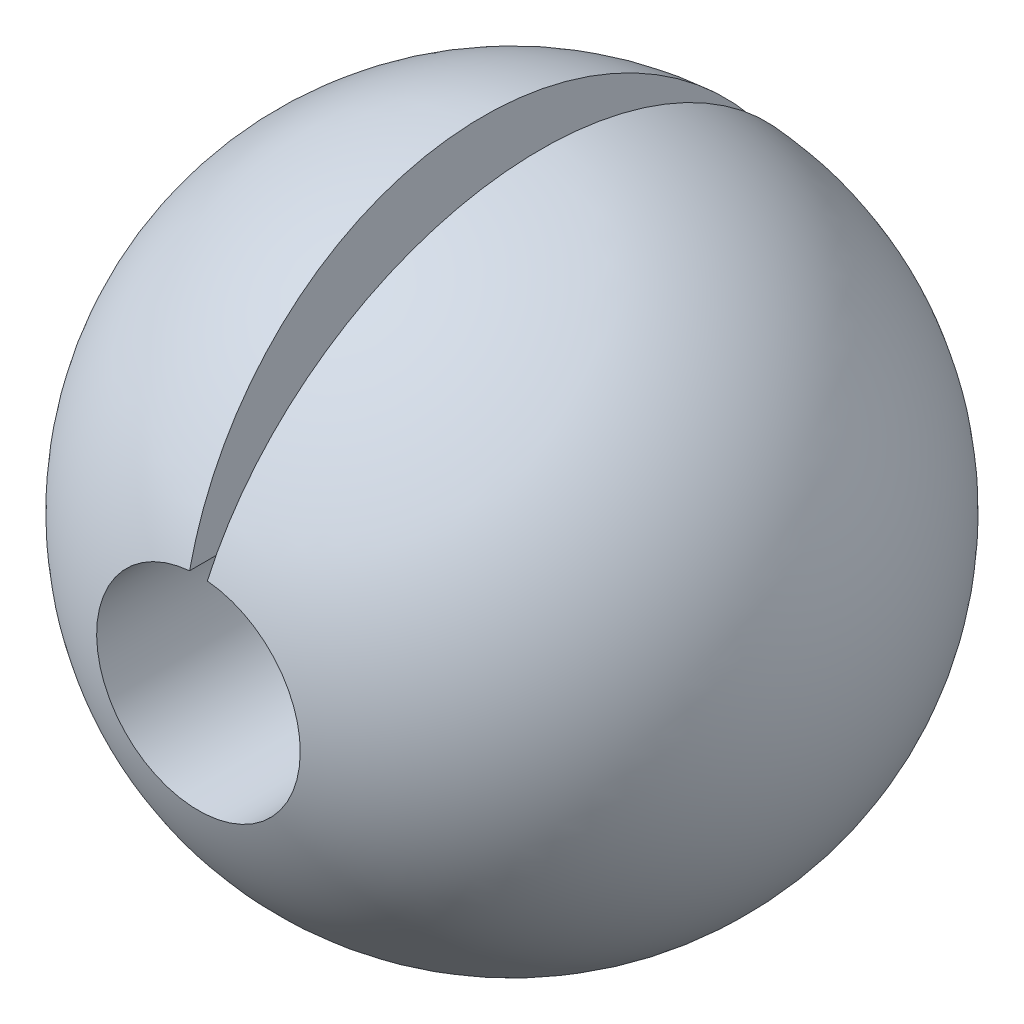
SolidWorks part; units mm, degrees
ref_plane "前视基准面" through (0, 0, 0) normal (0, 0, 1) x (1, 0, 0)
ref_plane "上视基准面" through (0, 0, 0) normal (0, 1, 0) x (1, 0, 0)
ref_plane "右视基准面" through (0, 0, 0) normal (1, 0, 0) x (0, 0, -1)
sketch "草图1" plane through (0, 0, 0) normal (0, 1, 0) x (1, 0, 0)
  line L0 (-202, 622.0225) -> (-202, -622.0225)
  line L1 (0, 0) -> (0, 433.0098) construction
  arc A0 (-202, 622.0225) -> (-202, -622.0225) centre (0, 0) ccw
  dimension "D2" = 1308
  dimension "D1" = 202
revolve "旋转1" add sketch "草图1" angle 360 about L1
sketch "草图2" plane through (0, 0, 0) normal (0, 0, 1) x (1, 0, 0)
  line L0 (0, 0) -> (0, 1015.3849) construction
  line L1 (0, 0) -> (-88.8347, 1015.3849)
  line L2 (-88.8347, 1015.3849) -> (88.8347, 1015.3849)
  line L3 (88.8347, 1015.3849) -> (0, 0)
  dimension "D1" = 5
extrude "切除-拉伸1" cut sketch "草图2" against normal through all both and the other way through all
